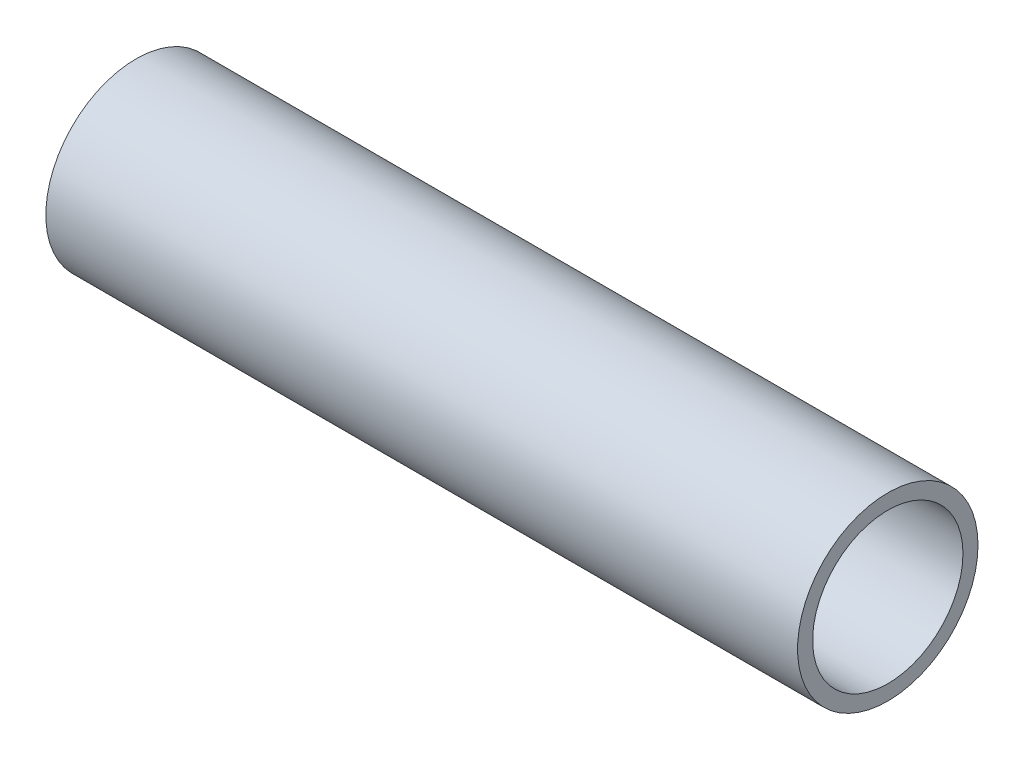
SolidWorks part; units mm, degrees
ref_plane "Front" through (0, 0, 0) normal (0, 0, 1) x (1, 0, 0)
ref_plane "Top" through (0, 0, 0) normal (0, 1, 0) x (1, 0, 0)
ref_plane "Right" through (0, 0, 0) normal (1, 0, 0) x (0, 0, -1)
sketch "Sketch1" plane through (0, 0, 0) normal (1, 0, 0) x (0, 0, -1)
  circle A0 centre (0, 0) radius 6
  circle A1 centre (0, 0) radius 5
  dimension "D1" = 10
  dimension "D2" = 12
extrude "Extrude1" add sketch "Sketch1" along normal mid plane 50
